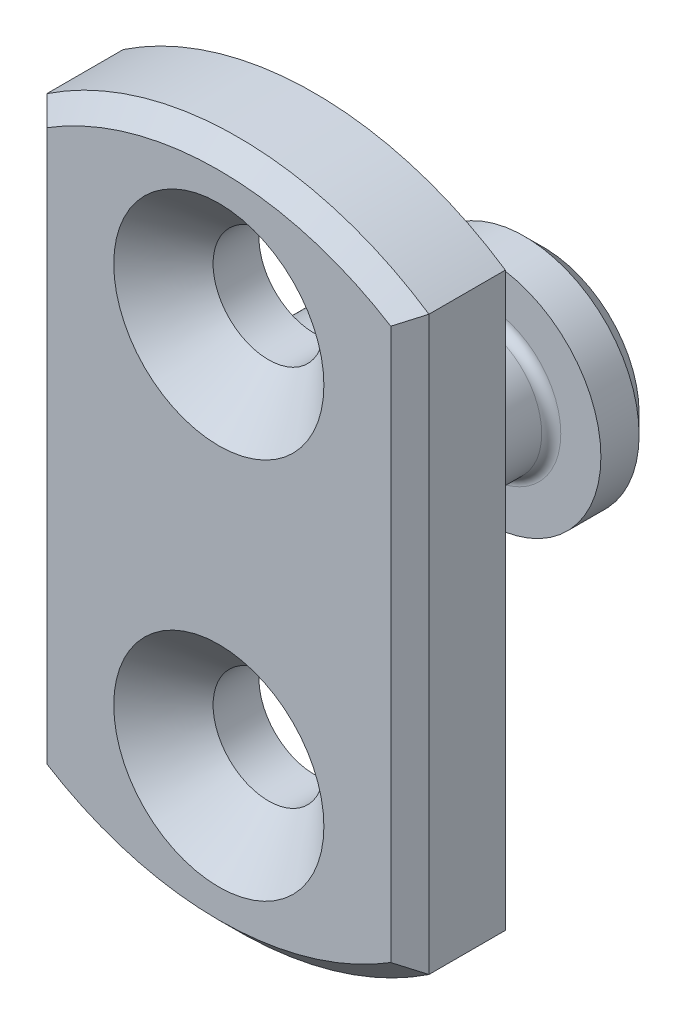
SolidWorks part; units mm, degrees
ref_plane "Front" through (0, 0, 0) normal (0, 0, 1) x (1, 0, 0)
ref_plane "Top" through (0, 0, 0) normal (0, 1, 0) x (1, 0, 0)
ref_plane "Right" through (0, 0, 0) normal (1, 0, 0) x (0, 0, -1)
sketch "Esquisse1" plane through (0, 0, 0) normal (0, 0, 1) x (1, 0, 0)
  circle A0 centre (0, 0) radius 3
  dimension "D1" = 6
extrude "Boss.-Extru.1" add sketch "Esquisse1" along normal blind 6
sketch "Esquisse2" plane through (0, 0, 6) normal (0, 0, 1) x (1, 0, 0)
  circle A0 centre (0, 0) radius 9
  dimension "D1" = 18
extrude "Boss.-Extru.2" add sketch "Esquisse2" along normal blind 2.5
sketch "Esquisse3" plane through (0, 0, 0) normal (0, 1, 0) x (1, 0, 0)
  line L0 (0, 0.3896) -> (0, -11.9093) construction
  line L1 (1.7, -1.5) -> (5, -1.5)
  line L2 (1.7, -1.5) -> (1.7, -4)
  line L3 (1.7, -4) -> (5, -4)
  line L4 (5, -1.5) -> (5, -4)
  line L5 (3, 0) -> (-3, 0) construction
  dimension "D1" = 3.4
  dimension "D2" = 2.5
  dimension "D3" = 10
  dimension "D4" = 1.5
revolve "Enlèvement de matière-Révolution1" cut sketch "Esquisse3" angle 360 about L0
fillet "Congé1" radius 0.25 2 edges at (-1.7, 0, 1.5) (-1.7, 0, 4)
chamfer "Chanfrein2" distance 0.5 angle 45 1 edges at (3, 0, 0)
sketch "Esquisse4" plane through (0, 0, 8.5) normal (0, 0, 1) x (1, 0, 0)
  line L1 (-5, 13.758) -> (5, 13.758)
  line L2 (-5, 13.758) -> (-5, -13.758)
  line L3 (-5, -13.758) -> (5, -13.758)
  line L4 (5, 13.758) -> (5, -13.758)
  line L5 (-5, 13.758) -> (5, -13.758) construction
  line L6 (-5, -13.758) -> (5, 13.758) construction
  point P0 (0, 0)
  dimension "D1" = 10
extrude "Enlèv. mat.-Extru.1" cut sketch "Esquisse4" against normal through all flip side to cut contours L2 L3 L4 L1
hole_wizard "Fraisage pour vis à tête fraisée M2.51" positions "Esquisse8" profile "Esquisse7" countersink size "M2.5" standard "Ansi Metric"
sketch "Esquisse8" plane through (0, 0, 8.5) normal (0, 0, 1) x (1, 0, 0)
  point P0 (0, 5)
  dimension "D1" = 5
sketch "Esquisse7" plane through (0, 5, 8.5) normal (1, 0, 0) x (0, -1, 0)
  line L0 (0, 0) -> (0, 4.8712)
  line L1 (0, 4.8712) -> (1.45, 4)
  line L2 (1.45, 4) -> (1.45, 1.3)
  line L3 (1.45, 1.3) -> (2.75, 0)
  line L5 (2.75, 0) -> (0, 0)
  line L6 (-1.45, 1.3) -> (-2.75, 0) construction
  line L10 (0, 4.8712) -> (-1.45, 4) construction
  line L11 (0, -6.35) -> (0, 107.95) construction
  dimension "Diamètre du perçage" = 2.9
  dimension "Profondeur du perçage" = 4
  dimension "Diamètre du fraisage entrant" = 5.5
  dimension "Angle du fraisage entrant" = 90
  dimension "Angle de pointe" = 118
pattern_circular "Répétition circulaire1" count 2 over 360 about axis through (0, 0, 0) along (0, 0, 1) of "Fraisage pour vis à tête fraisée M2.51"
chamfer "Chanfrein3" distance 0.5 angle 45 4 edges at (0, 9, 8.5) (0, -9, 8.5) (5, 0, 8.5) (-5, 0, 8.5)
